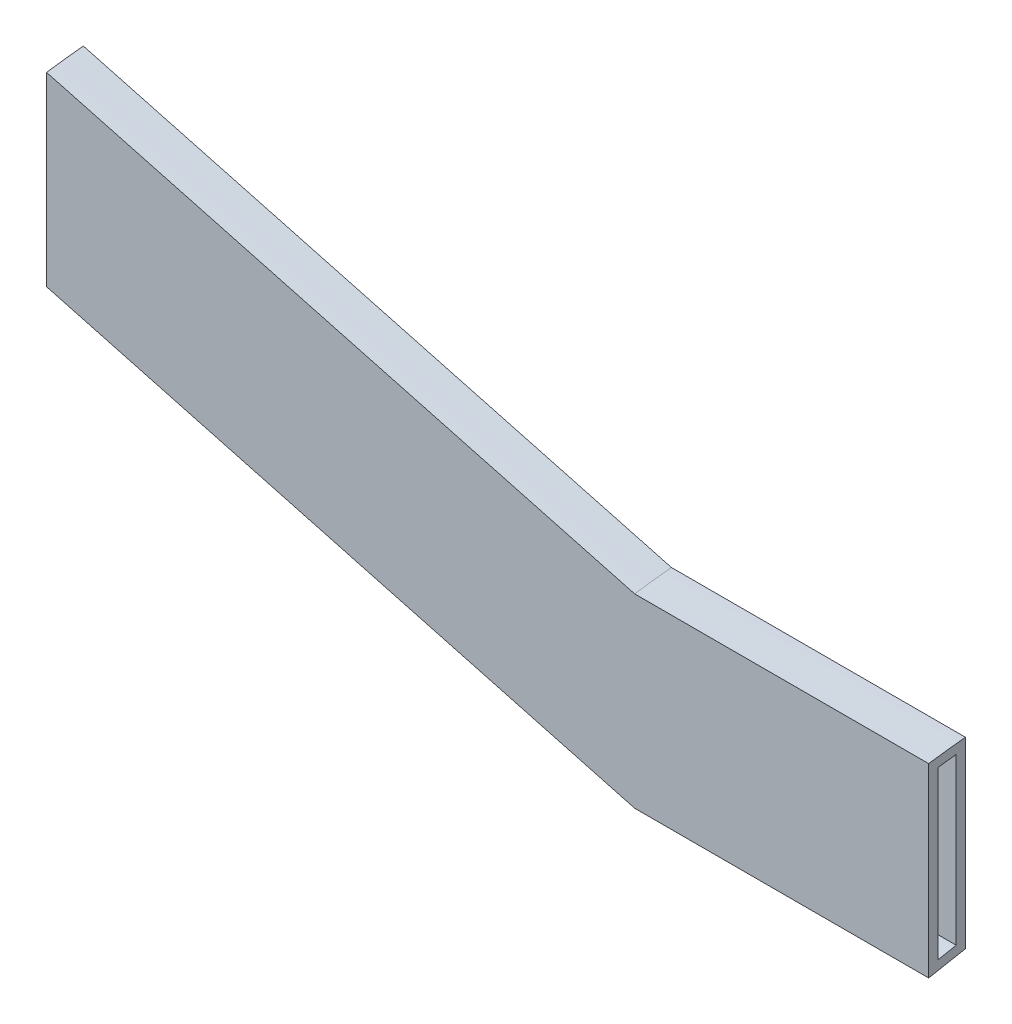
SolidWorks part; units mm, degrees
ref_plane "Front Plane" through (0, 0, 0) normal (0, 0, 1) x (1, 0, 0)
ref_plane "Top Plane" through (0, 0, 0) normal (0, 1, 0) x (1, 0, 0)
ref_plane "Right Plane" through (0, 0, 0) normal (1, 0, 0) x (0, 0, -1)
curve "Curve1"
sketch "Sketch1" plane through (0, 0, 0) normal (1, 0, 0) x (0, 0, -1)
  line L0 (32.5438, 18.2236) -> (32.5438, 2.1862)
  line L1 (0, 0) -> (0, 95.7684) construction
  line L4 (35.7188, 18.6104) -> (35.7187, 2.7868)
  line L5 (33.3375, 17.5323) -> (33.3375, 3.1448)
  line L6 (34.925, 17.7278) -> (34.925, 3.445)
  spline S0 degree 1 poles (34.925, 17.7278) (33.3375, 17.5323) knots 0 0 1 1 construction
  spline S1 degree 1 poles (33.3375, 3.1448) (34.925, 3.445) knots 0 0 1 1 construction
  spline S2 degree 3 poles (34.925, 17.7278) (34.3952, 17.6683) (33.8659, 17.6031) (33.3375, 17.5323) knots 0.373628 0.373628 0.373628 0.373628 0.378966 0.378966 0.378966 0.378966
  spline S3 degree 3 poles (33.3375, 3.1448) (33.8666, 3.2451) (34.3958, 3.3452) (34.925, 3.445) knots 0.626492 0.626492 0.626492 0.626492 0.631768 0.631768 0.631768 0.631768
  spline S4 degree 3 poles (32.5438, 2.1862) (33.6019, 2.3872) (34.6602, 2.5877) (35.7187, 2.7868) knots 0.623361 0.623361 0.623361 0.623361 0.633917 0.633917 0.633917 0.633917
  spline S5 degree 3 poles (35.7188, 18.6104) (34.6579, 18.504) (33.5991, 18.3748) (32.5438, 18.2236) knots 0.370698 0.370698 0.370698 0.370698 0.381261 0.381261 0.381261 0.381261
  dimension "D1" = 0.7937
extrude "Boss-Extrude1" add sketch "Sketch1" along normal blind 25.4
ref_plane "Plane1" through (76.2, 0, 0) normal (1, 0, 0) x (0, 0, -1)
sketch "Sketch4" plane through (0, 0, -32.5438) normal (0, 0, 1) x (1, 0, 0)
  line L0 (25.4, 2.1862) -> (76.2, 15.798)
  line L1 (76.2, -1.7462) -> (76.2, 1.7462) construction
  line L2 (25.4, 2.1862) -> (76.2, 2.1862) construction
  dimension "D1" = 15
sketch "Sketch7" plane through (25.4, 0, 0) normal (1, 0, 0) x (0, 0, -1)
  line L2 (33.3375, 17.5323) -> (33.3375, 3.1448)
  line L3 (34.925, 3.445) -> (34.925, 17.7278)
  line L4 (33.3375, 17.5323) -> (33.3375, 3.1448)
  line L5 (34.925, 3.445) -> (34.925, 17.7278)
  line L6 (32.5438, 18.2236) -> (32.5438, 2.1862)
  line L7 (35.7187, 2.7868) -> (35.7188, 18.6104)
  line L8 (32.5438, 18.2236) -> (32.5438, 2.1862)
  line L9 (35.7187, 2.7868) -> (35.7188, 18.6104)
  arc A2 (34.925, 3.445) -> (33.3375, 3.1448) centre (358.2969, -1710.7805) ccw
  arc A3 (34.925, 17.7278) -> (33.3375, 17.5323) centre (43.2849, -56.7055) ccw
  arc A4 (34.925, 3.445) -> (33.3375, 3.1448) centre (358.2969, -1710.7805) ccw
  arc A5 (34.925, 17.7278) -> (33.3375, 17.5323) centre (43.2849, -56.7055) ccw
  spline S2 degree 3 poles (-1007.3628, 2788.1322) (396.9964, -2913.3467) (-337.2167, 2917.6668) (1068.4864, -2787.387) knots -1.058146 -1.058146 -1.058146 -1.058146 2.288332 2.288332 2.288332 2.288332 only from (32.5438, 2.1862) to (35.7187, 2.7868)
  spline S3 degree 3 poles (-1668.5071, -2414.7589) (2558.4252, 2152.2862) (-2924.5658, -1636.6903) (2862.6229, 967.3231) knots -0.872323 -0.872323 -0.872323 -0.872323 1.778057 1.778057 1.778057 1.778057 only from (35.7188, 18.6104) to (32.5438, 18.2236)
  spline S4 degree 3 poles (32.5438, 2.1862) (33.6019, 2.3872) (34.6602, 2.5877) (35.7187, 2.7868) knots 0.623361 0.623361 0.623361 0.623361 0.633917 0.633917 0.633917 0.633917
  spline S5 degree 3 poles (35.7188, 18.6104) (34.6579, 18.504) (33.5991, 18.3748) (32.5438, 18.2236) knots 0.370698 0.370698 0.370698 0.370698 0.381261 0.381261 0.381261 0.381261
  dimension "D1" = 0
  dimension "D2" = 0
sweep "Sweep1" add profiles "Sketch7" path "Sketch4"
mirror "Mirror1" about plane through (0, 0, 0) normal (1, 0, 0) of "Sweep1", "Boss-Extrude1"
sketch "Sketch9" plane through (0, 0, 0) normal (1, 0, 0) x (0, 0, -1)
  line L1 (39.8296, 33.6357) -> (22.9988, 33.6357)
  line L2 (39.8296, 33.6357) -> (39.8296, 1.2207)
  line L3 (39.8296, 1.2207) -> (22.9988, 1.2207)
  line L4 (22.9988, 33.6357) -> (22.9988, 1.2207)
extrude "Cut-Extrude1" cut sketch "Sketch9" along normal through all
